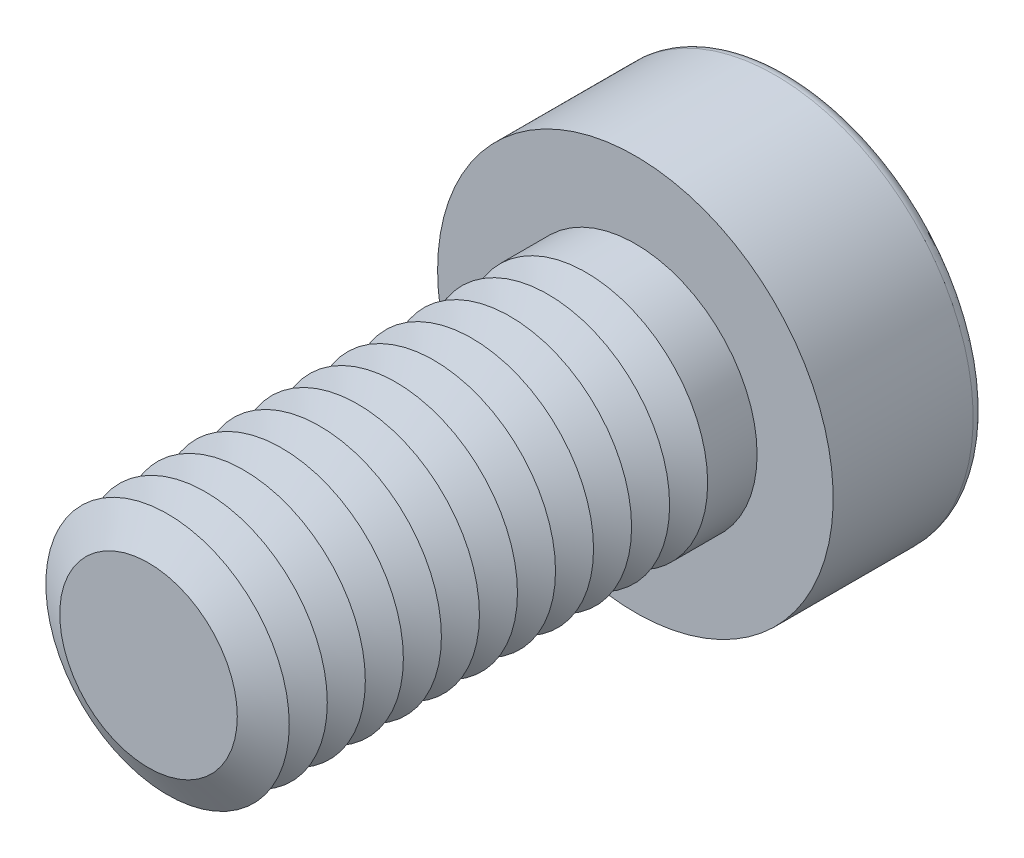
SolidWorks part; units mm, degrees
ref_plane "Front Plane" through (0, 0, 0) normal (0, 0, 1) x (1, 0, 0)
ref_plane "Top Plane" through (0, 0, 0) normal (0, 1, 0) x (1, 0, 0)
ref_plane "Right Plane" through (0, 0, 0) normal (1, 0, 0) x (0, 0, -1)
sketch "Sketch1" plane through (0, 0, 0) normal (0, 0, 1) x (1, 0, 0)
  circle A0 centre (0, 0) radius 4
  dimension "D1" = 8
extrude "Boss-Extrude1" add sketch "Sketch1" along normal blind 16
sketch "Sketch2" plane through (0, 0, 0) normal (0, 0, -1) x (-1, 0, 0)
  circle A0 centre (0, 0) radius 6.5
  dimension "D1" = 13
extrude "Boss-Extrude2" add sketch "Sketch2" along normal blind 5
sketch "Sketch3" plane through (0, 0, -5) normal (0, 0, -1) x (-1, 0, 0)
  line L1 (-1.4434, 2.5) -> (-2.8868, 0)
  line L2 (-2.8868, 0) -> (-1.4434, -2.5)
  line L3 (-1.4434, -2.5) -> (1.4434, -2.5)
  line L4 (1.4434, -2.5) -> (2.8868, 0)
  line L5 (2.8868, 0) -> (1.4434, 2.5)
  line L6 (1.4434, 2.5) -> (-1.4434, 2.5)
  circle A0 centre (0, 0) radius 2.5 construction
  dimension "D1" = 5
extrude "Cut-Extrude1" cut sketch "Sketch3" against normal blind 3.75
fillet "Fillet1" radius 0.4 1 edges at (-6.5, 0, -5)
sketch "Sketch4" plane through (0, 0, -1.25) normal (0, 0, -1) x (-1, 0, 0)
  line L0 (1.4434, -2.5) -> (2.8868, 0) construction
  circle A0 centre (0, 0) radius 2.5
extrude "Cut-Extrude2" cut sketch "Sketch4" against normal through all draft 60
sketch "Sketch5" plane through (0, 0, -5) normal (0, 0, -1) x (-1, 0, 0)
  circle A0 centre (0, 0) radius 2.8868
extrude "Cut-Extrude3" cut sketch "Sketch5" against normal through all draft 75
sketch "Sketch7" plane through (0, 0, 0) normal (1, 0, 0) x (0, 0, -1)
  line L25 (-16, 2.9175) -> (-15.375, 4)
  line L26 (-16, 4) -> (-16, -4) construction
  line L27 (-15.375, 4) -> (-16.625, 4)
  line L28 (-16.625, 4) -> (-16, 2.9175)
  line L29 (0, 4) -> (-16, 4) construction
  dimension "D1" = 1.25
revolve "Cut-Revolve1" cut sketch "Sketch7" angle 360 about axis through (0, 0, 16) along (0, 0, -1)
pattern_linear "LPattern1" count 12 spacing 1.25 along (0, 0, -1) of "Cut-Revolve1"
